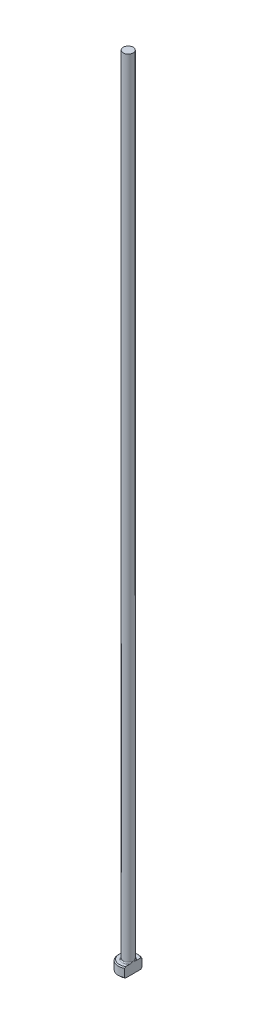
SolidWorks part; units mm, degrees
ref_plane "Front Plane" through (0, 0, 0) normal (0, 0, 1) x (1, 0, 0)
ref_plane "Top Plane" through (0, 0, 0) normal (0, 1, 0) x (1, 0, 0)
ref_plane "Right Plane" through (0, 0, 0) normal (1, 0, 0) x (0, 0, -1)
sketch "Sketch1" plane through (0, 0, 0) normal (0, 0, 1) x (1, 0, 0)
  line L0 (0, 259.9588) -> (0, -15.1925) construction
  line L1 (0, 0) -> (-2, 0)
  line L2 (-2, 0) -> (-2, 2)
  line L3 (-2, 2) -> (-1, 2)
  line L4 (-1, 2) -> (-1, 160)
  line L5 (-1, 160) -> (0, 160)
  line L6 (0, 160) -> (0, 0)
  dimension "L" = 160
  dimension "H" = 4
  dimension "T" = 2
  dimension "D" = 2
revolve "Revolve1" add sketch "Sketch1" angle 360 about L0
chamfer "Chamfer1" distance 0.2 angle 45 2 edges at (0, 2, 2) (0, 0, 2)
fillet "Fillet1" radius 0.2 1 edges at (0, 2, 1)
sketch "Sketch2" plane through (0, 0, 0) normal (0, 1, 0) x (1, 0, 0)
  line L0 (1, 1.7321) -> (1, -1.7321)
  circle A0 centre (0, 0) radius 2 construction
  arc A1 (1, -1.7321) -> (1, 1.7321) centre (0, 0) ccw
  circle A2 centre (0, 0) radius 1 construction
extrude "KEY" cut sketch "Sketch2" along normal through all
